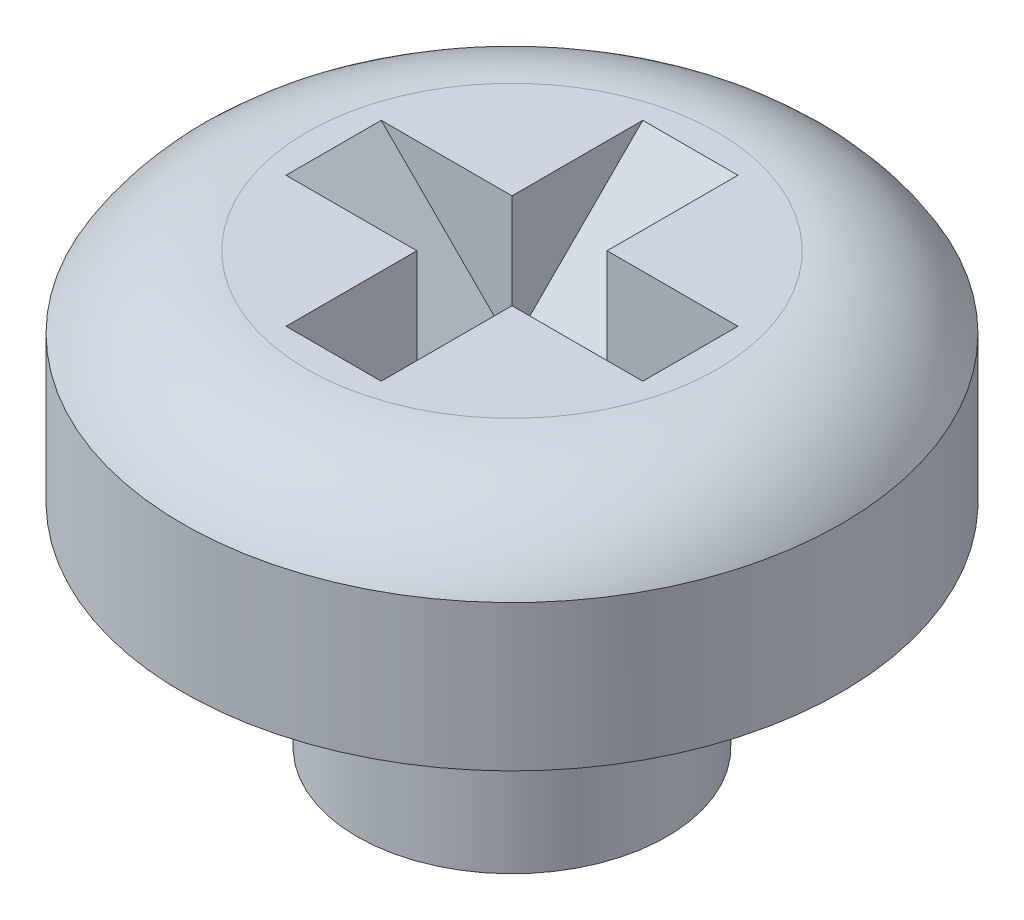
SolidWorks part; units mm, degrees
ref_plane "Front" through (0, 0, 0) normal (0, 0, 1) x (1, 0, 0)
ref_plane "Top" through (0, 0, 0) normal (0, 1, 0) x (1, 0, 0)
ref_plane "Right" through (0, 0, 0) normal (1, 0, 0) x (0, 0, -1)
imported_body "Imported1"
sketch "Sketch1" plane through (0, 145.5789, 0) normal (0, -1, 0) x (1, 0, 0)
  circle A0 centre (0, 0) radius 5.1797
sketch "Sketch2" plane through (0, 135.9269, 0) normal (0, -1, 0) x (1, 0, 0)
  circle A0 centre (0, 0) radius 4.0181
extrude "Cut-Extrude1" cut sketch "Sketch2" against normal blind 6.35
sketch "Sketch3" plane through (0, 145.5789, 0) normal (0, -1, 0) x (1, 0, 0)
  circle A0 centre (0.6954, 0) radius 2.4044 construction
  circle A1 centre (0.6954, 0) radius 2.4044
extrude "Extrude1" add sketch "Sketch3" along normal up to surface (3.302 mm away)
other "DeleteFace3"
